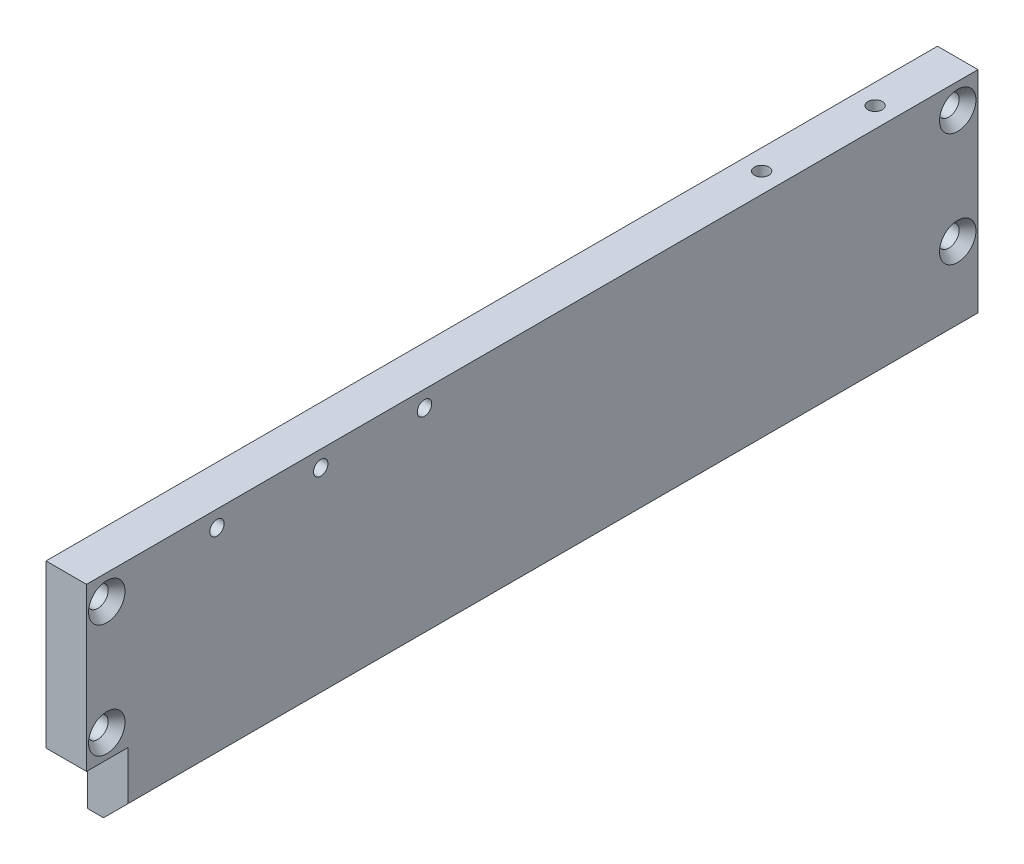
SolidWorks part; units mm, degrees
ref_plane "Front Plane" through (0, 0, 0) normal (0, 0, 1) x (1, 0, 0)
ref_plane "Top Plane" through (0, 0, 0) normal (0, 1, 0) x (1, 0, 0)
ref_plane "Right Plane" through (0, 0, 0) normal (1, 0, 0) x (0, 0, -1)
sketch "Sketch1" plane through (0, 0, 0) normal (1, 0, 0) x (0, 0, -1)
  line L1 (-69.85, 26.67) -> (69.85, 26.67)
  line L2 (-69.85, 26.67) -> (-69.85, -10.16)
  line L3 (-69.85, -10.16) -> (69.85, -10.16)
  line L4 (69.85, 26.67) -> (69.85, -10.16)
  dimension "D1" = 36.83
  dimension "D2" = 139.7
  dimension "D3" = 10.16
  dimension "D4" = 69.85
extrude "Extrude1" add sketch "Sketch1" along normal blind 6.35
sketch "Sketch2" plane through (6.35, 0, 0) normal (1, 0, 0) x (0, 0, -1)
  line L0 (-69.85, 26.67) -> (-69.85, -10.16) construction
  line L1 (69.85, -10.16) -> (69.85, 26.67) construction
  line L3 (69.85, 26.67) -> (-69.85, 26.67) construction
  point P0 (-66.675, 22.733)
  point P1 (-66.675, 4.953)
  point P2 (66.675, 22.733)
  point P3 (66.675, 4.953)
  dimension "D1" = 17.78
  dimension "D2" = 3.175
  dimension "D3" = 3.175
  dimension "D4" = 3.937
hole_wizard "CSK for #4 Flat Head Machine Screw1" positions "3DSketch1" profile "Sketch3" countersink size "#4" standard "Ansi Inch"
sketch3d "3DSketch1"
  point P0 (6.35, 22.733, 66.675)
  point P3 (6.35, 4.953, 66.675)
  point P6 (6.35, 22.733, -66.675)
  point P9 (6.35, 4.953, -66.675)
sketch "Sketch3" plane through (6.35, 22.733, 66.675) normal (0, 1, 0) x (0, 0, -1)
  line L0 (0, 0) -> (0, 6.35)
  line L1 (0, 6.35) -> (1.6319, 6.35)
  line L2 (1.6319, 6.35) -> (1.6319, 1.4098)
  line L3 (1.6319, 1.4098) -> (2.8575, 0)
  line L5 (2.8575, 0) -> (0, 0)
  line L6 (-1.6319, 1.4098) -> (-2.8575, 0) construction
  line L11 (0, -6.35) -> (0, 107.95) construction
  dimension "Thru Hole Dia." = 3.2639
  dimension "Thru Hole Depth" = 6.35
  dimension "Near C'Sink Dia." = 5.715
  dimension "Near C'Sink Angle" = 82
hole_wizard "#4-40 Tapped Hole1" positions "3DSketch2" profile "Sketch4" tap size "#4-40" standard "Ansi Inch"
sketch3d "3DSketch2"
  line L1 (6.35, 26.67, -69.85) -> (6.35, 26.67, 69.85) construction
  line L2 (6.35, 26.67, -69.85) -> (0, 26.67, -69.85) construction
  point P0 (3.175, 26.67, -39.116)
  point P2 (3.175, 26.67, -56.896)
  point P13 (-19.4149, 102.494, 0)
  dimension "D1" = 12.954
  dimension "D2" = 17.78
  dimension "D3" = 3.175
sketch "Sketch4" plane through (3.175, 26.67, -39.116) normal (1, 0, 0) x (0, 0, 1)
  line L0 (0, 0) -> (0, 12.1092)
  line L1 (0, 12.1092) -> (1.1303, 11.43)
  line L2 (1.1303, 11.43) -> (1.1303, 0)
  line L5 (1.1303, 0) -> (0, 0)
  line L10 (0, 12.1092) -> (-1.1303, 11.43) construction
  line L11 (0, -6.35) -> (0, 107.95) construction
  dimension "Tap Drill Dia." = 2.2606
  dimension "Tap Drill Depth" = 11.43
  dimension "Drill Angle" = 118
hole_wizard "#4-40 Tapped Hole2" positions "3DSketch3" profile "Sketch5" tap size "#4-40" standard "Ansi Inch"
sketch3d "3DSketch3"
  line L0 (6.35, -10.16, -69.85) -> (0, -10.16, -69.85) construction
  line L1 (6.35, -10.16, 69.85) -> (6.35, -10.16, -69.85) construction
  point P0 (3.175, -10.16, -39.116)
  point P2 (3.175, -10.16, -56.896)
  dimension "D1" = 12.954
  dimension "D2" = 17.78
  dimension "D3" = 3.175
sketch "Sketch5" plane through (3.175, -10.16, -39.116) normal (1, 0, 0) x (0, 0, -1)
  line L0 (0, 0) -> (0, 12.1092)
  line L1 (0, 12.1092) -> (1.1303, 11.43)
  line L2 (1.1303, 11.43) -> (1.1303, 0)
  line L5 (1.1303, 0) -> (0, 0)
  line L10 (0, 12.1092) -> (-1.1303, 11.43) construction
  line L11 (0, -6.35) -> (0, 107.95) construction
  dimension "Tap Drill Dia." = 2.2606
  dimension "Tap Drill Depth" = 11.43
  dimension "Drill Angle" = 118
sketch "Sketch6" plane through (6.35, 0, 0) normal (1, 0, 0) x (0, 0, -1)
  line L1 (-69.85, -10.16) -> (-63.373, -10.16)
  line L2 (-69.85, -10.16) -> (-69.85, 1.27)
  line L3 (-69.85, 1.27) -> (-63.373, 1.27)
  line L4 (-63.373, -10.16) -> (-63.373, 1.27)
  dimension "D1" = 6.477
  dimension "D2" = 11.43
extrude "Extrude2" cut sketch "Sketch6" against normal through all
chamfer "Chamfer1" distance 3.81 angle 45 1 edges at (6.35, -10.16, -3.2385)
hole_wizard "#4-40 Tapped Hole3" positions "3DSketch4" profile "Sketch7" tap size "#4-40" standard "Ansi Inch"
sketch3d "3DSketch4"
  line L0 (0, -10.16, 63.373) -> (0, 1.27, 63.373) construction
  line L1 (0, -10.16, 63.373) -> (0, -10.16, -69.85) construction
  point P0 (0, 24.13, 49.403)
  point P2 (0, 24.13, 33.147)
  point P4 (0, 24.13, 16.891)
  point P6 (0, -7.62, 49.403)
  point P8 (0, -7.62, 33.147)
  point P10 (0, -7.62, 16.891)
  dimension "D1" = 13.97
  dimension "D2" = 16.256
  dimension "D3" = 16.256
  dimension "D4" = 31.75
  dimension "D5" = 2.54
sketch "Sketch7" plane through (0, 24.13, 49.403) normal (0, 1, 0) x (0, 0, 1)
  line L0 (0, 0) -> (0, 6.35)
  line L1 (0, 6.35) -> (1.1303, 6.35)
  line L2 (1.1303, 6.35) -> (1.1303, 0)
  line L5 (1.1303, 0) -> (0, 0)
  line L11 (0, -6.35) -> (0, 107.95) construction
  dimension "Thru Tap Drill Dia." = 2.2606
  dimension "Thru Tap Drill Depth" = 6.35
